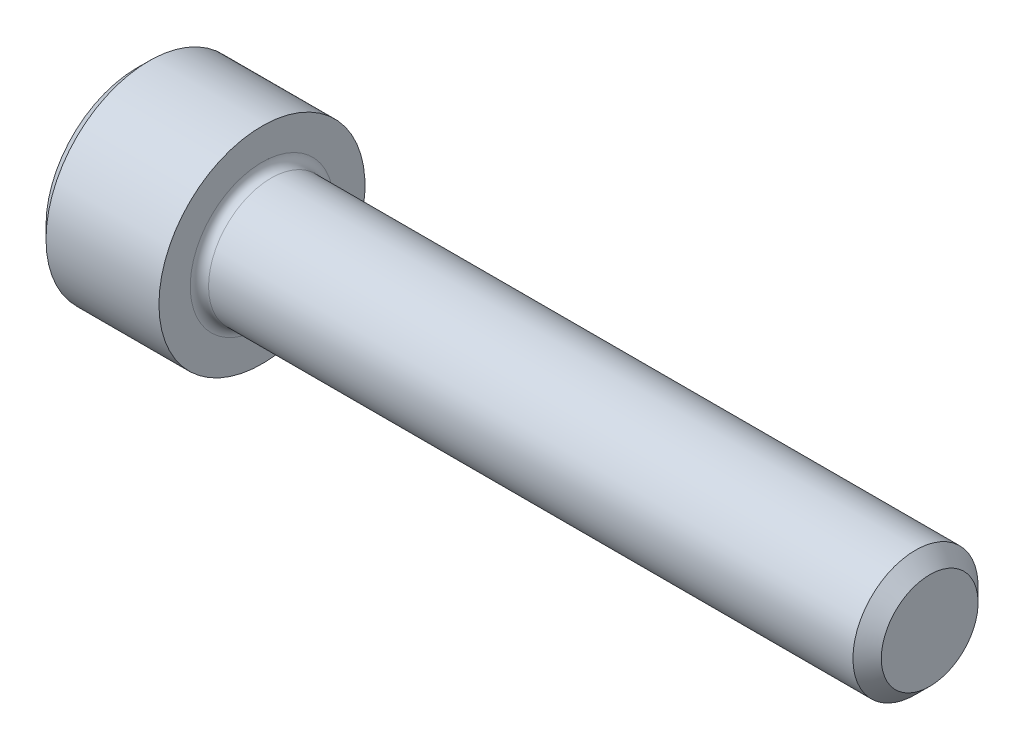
SolidWorks part; units mm, degrees
ref_plane "Plane1" through (0, 0, 0) normal (0, 0, 1) x (1, 0, 0)
ref_plane "Plane2" through (0, 0, 0) normal (0, 1, 0) x (1, 0, 0)
ref_plane "Plane3" through (0, 0, 0) normal (1, 0, 0) x (0, 0, -1)
revolve "Base-Revolve" add sketch "BodySke"
sketch "BodySke"
  dimension "Diameter" = 4.1656
  dimension "Head_ht" = 4.1656
  dimension "Length" = 22.225
  dimension "Body_ch_ang" = 45
  dimension "Head_dia" = 6.858
  dimension "Head_ch_ang" = 45
  dimension "Head_side_ht" = 3.7592
  dimension "Minor_dia" = 3.2207
  dimension "Advance" = 0.7925
  dimension "Thread_nom" = 22.225
  dimension "Thread_length" = 38.1
fillet "Fillet1" radius 0.3048 1 edges at (4.1656, 0, 2.0828)
sketch "Sketch2"
  dimension "D1" = 1.778
  dimension "D2" = 60
  dimension "Wall_thickness" = 2.2098
revolve "Hex-PreBroach" cut sketch "Sketch2" angle 360 about L6
sketch "Sketch3"
  dimension "D1" = 1.778
  dimension "D2" = 1.778
  dimension "Hex_size" = 3.556
extrude "Hex" cut sketch "Sketch3" against normal blind 1.9558
sketch "Sketch4"
  dimension "D1" = 30
  dimension "Spline_n_dim" = 3.81
  dimension "Spline_m_dim" = 4.3942
  dimension "D2" = 60
  dimension "D3" = 0.4572
  dimension "Spline_p_dim" = 0.9144
extrude "Spline" [suppressed] cut sketch "Sketch4" against normal blind 1.9558
pattern_circular "CirPattern1" [suppressed] count 6 every 60
sketch "Sketch5"
  dimension "Drilled_hole_dia" = 1.1811
  dimension "Drilled_hole_loc" = 1.524
extrude "Hole" [suppressed] cut sketch "Sketch5" against normal through all and the other way through all
pattern_circular "Drilled-4" [suppressed] count 2 every 60
pattern_circular "Drilled-6" [suppressed] count 3 every 60
sketch "ThdSchSke"
  dimension "Thread_minor" = 3.2207
  dimension "Diameter" = 4.1656
  dimension "Start" = 4.9581
  dimension "SideAngle" = 55
  dimension "VeeAngle" = 70
  dimension "Overcut" = 5.207
revolve "ThreadSchematic" [suppressed] cut sketch "ThdSchSke" angle 360 about L3
pattern_linear "ThdSchPat" [suppressed]
equation "\"D2@Sketch3\" = \"Hex_size@Sketch3\" / 2"
equation "\"D1@Sketch3\" = \"Hex_size@Sketch3\" / 2"
equation "\"D1@Sketch2\" = \"Hex_size@Sketch3\" / 2"
equation "\"D3@Sketch4\" = \"Spline_p_dim@Sketch4\" / 2"
equation "\"Thread_minor@ThreadCosmetic\"  =  \"Minor_dia@BodySke\""
equation "\"D2@CirPattern1\" = 360 / \"Num_teeth@CirPattern1\""
equation "\"Wall_thickness@Sketch2\" = \"Head_ht@BodySke\" - \"Key_eng@Hex\""
equation "\"Thread_length@ThreadCosmetic\" = ((sgn( (\"Length@BodySke\" - \"Advance@BodySke\" ) - \"Thread_nom@BodySke\" )-1)*( (\"Length@BodySke\" - \"Advance@BodySke\" ) - \"Thread_nom@BodySke\" ))/-2+ \"Thread_nom@BodySke\""
equation "\"Thread_minor@ThdSchSke\" = \"Minor_dia@BodySke\""
equation "\"Diameter@ThdSchSke\" = \"Diameter@BodySke\""
equation "\"Overcut@ThdSchSke\" = \"Diameter@BodySke\" * 1.25"
equation "\"Start@ThdSchSke\" = \"Head_ht@BodySke\" + \"Length@BodySke\" - \"Thread_length@ThreadCosmetic\"  '---Non-countersunk---"
equation "\"Num_threads@ThdSchPat\" = int( \"Thread_length@ThreadCosmetic\" / \"Advance@BodySke\" + 0.999 )  + 1"
equation "\"Advance@ThdSchPat\" = \"Thread_length@ThreadCosmetic\" /  (\"Num_threads@ThdSchPat\" - 1) 'relax it"
equation "\"Num_threads@ThdSchPat\" = \"Num_threads@ThdSchPat\" - sgn( \"Num_threads@ThdSchPat\" - 1) '---chamfered tips only---"
